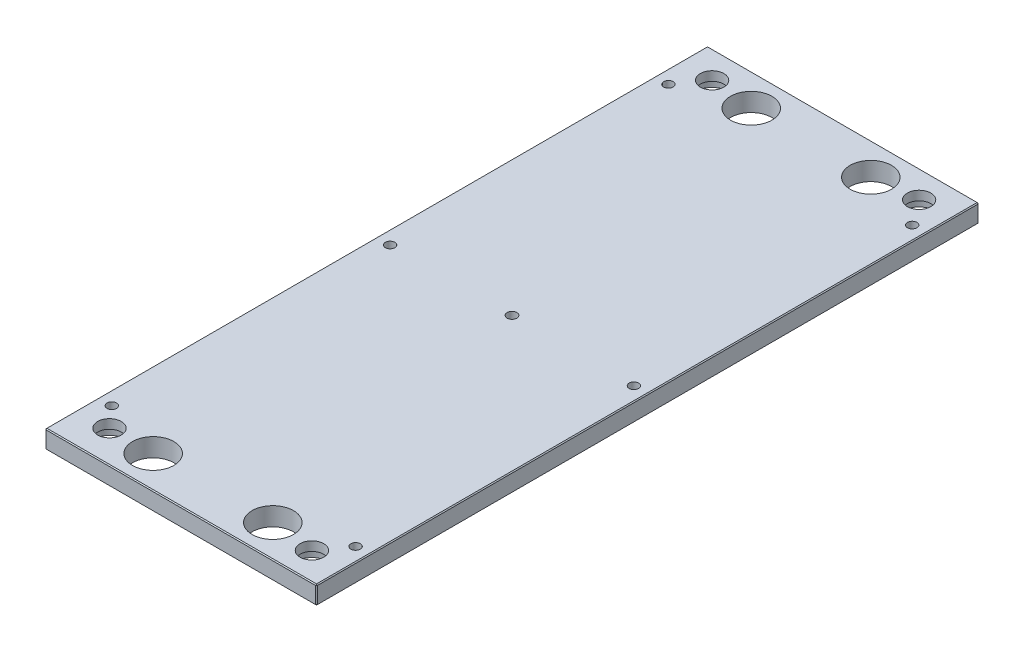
SolidWorks part; units mm, degrees
ref_plane "Plane1" through (0, 0, 0) normal (0, 0, 1) x (1, 0, 0)
ref_plane "Plane2" through (0, 0, 0) normal (0, 1, 0) x (1, 0, 0)
ref_plane "Plane3" through (0, 0, 0) normal (1, 0, 0) x (0, 0, -1)
sketch "Sketch1" plane through (0, 0, 0) normal (0, 0, 1) x (1, 0, 0)
  line L0 (-93.6625, -12.7) -> (93.6625, -12.7)
  line L1 (-93.6625, -12.7) -> (-93.6625, -25.4)
  line L2 (93.6625, -25.4) -> (-93.6625, -25.4)
  line L3 (93.6625, -25.4) -> (93.6625, -12.7)
  dimension "HT" = 12.7
  dimension "W" = 187.325
  dimension "halfW" = 93.6625
extrude "Base-Extrude" add sketch "Sketch1" along normal mid plane 457.2
hole_wizard "RP1" positions "RP1ctrl" profile "RP1rev" legacy
sketch "RP1ctrl" plane through (0, -25.4, 0) normal (0, -1, 0) x (1, 0, 0)
  point P0 (71.4375, -209.55)
sketch "RP1rev" plane through (71.4375, -25.4, -209.55) normal (1, 0, 0) x (0, 0, -1)
  line L0 (0, 0) -> (0, 12.7)
  line L1 (0, 12.7) -> (8.1359, 12.7)
  line L2 (8.1359, 12.7) -> (8.1359, 6.35)
  line L3 (8.1359, 6.35) -> (11.9062, 6.35)
  line L4 (11.9062, 6.35) -> (11.9062, 0)
  line L5 (11.9062, 0) -> (0, 0)
  line L6 (0, 110) -> (0, -10) construction
  dimension "Depth" = 12.7
hole_wizard "RP2" positions "RP2ctrl" profile "RP2rev" legacy
sketch "RP2ctrl" plane through (0, -25.4, 0) normal (0, -1, 0) x (1, 0, 0)
  point P0 (71.4375, 209.55)
sketch "RP2rev" plane through (71.4375, -25.4, 209.55) normal (1, 0, 0) x (0, 0, -1)
  line L0 (0, 0) -> (0, 12.7)
  line L1 (0, 12.7) -> (8.1359, 12.7)
  line L2 (8.1359, 12.7) -> (8.1359, 6.35)
  line L3 (8.1359, 6.35) -> (11.9062, 6.35)
  line L4 (11.9062, 6.35) -> (11.9062, 0)
  line L5 (11.9062, 0) -> (0, 0)
  line L6 (0, 110) -> (0, -10) construction
  dimension "Depth" = 12.7
hole_wizard "RP3" positions "RP3ctrl" profile "RP3rev" legacy
sketch "RP3ctrl" plane through (0, -25.4, 0) normal (0, -1, 0) x (1, 0, 0)
  point P0 (-71.4375, 206.375)
sketch "RP3rev" plane through (-71.4375, -25.4, 206.375) normal (1, 0, 0) x (0, 0, -1)
  line L0 (0, 0) -> (0, 12.7)
  line L1 (0, 12.7) -> (8.1359, 12.7)
  line L2 (8.1359, 12.7) -> (8.1359, 6.35)
  line L3 (8.1359, 6.35) -> (11.9062, 6.35)
  line L4 (11.9062, 6.35) -> (11.9062, 0)
  line L5 (11.9062, 0) -> (0, 0)
  line L6 (0, 110) -> (0, -10) construction
  dimension "Depth" = 12.7
hole_wizard "RP4" positions "RP4ctrl" profile "RP4rev" legacy
sketch "RP4ctrl" plane through (0, -25.4, 0) normal (0, -1, 0) x (1, 0, 0)
  point P0 (-71.4375, -209.55)
sketch "RP4rev" plane through (-71.4375, -25.4, -209.55) normal (1, 0, 0) x (0, 0, -1)
  line L0 (0, 0) -> (0, 12.7)
  line L1 (0, 12.7) -> (8.1359, 12.7)
  line L2 (8.1359, 12.7) -> (8.1359, 6.35)
  line L3 (8.1359, 6.35) -> (11.9062, 6.35)
  line L4 (11.9062, 6.35) -> (11.9062, 0)
  line L5 (11.9062, 0) -> (0, 0)
  line L6 (0, 110) -> (0, -10) construction
  dimension "Depth" = 12.7
hole_wizard "SP" positions "SPctrl" profile "SPrev" legacy
sketch "SPctrl" plane through (0, -25.4, 0) normal (0, -1, 0) x (1, 0, 0)
  point P0 (0, 0)
sketch "SPrev" plane through (0, -25.4, 0) normal (1, 0, 0) x (0, 0, -1)
  line L0 (0, 0) -> (0, 12.7)
  line L1 (0, 12.7) -> (3.3734, 12.7)
  line L2 (3.3734, 12.7) -> (3.3734, 6.35)
  line L3 (3.3734, 6.35) -> (6.35, 6.35)
  line L4 (6.35, 6.35) -> (6.35, 0)
  line L5 (6.35, 0) -> (0, 0)
  line L6 (0, 110) -> (0, -10) construction
  dimension "Diameter" = 6.7469
  dimension "Depth" = 12.7
  dimension "C-Bore Diameter" = 12.7
  dimension "C-Bore Depth" = 6.35
other "Tap1"
sketch "Tap1ctrl" plane through (0, -12.7, 0) normal (0, 1, 0) x (-1, 0, 0)
  circle A0 centre (-84.1375, -192.0875) radius 3.2639
sketch "Tap2ctrl" plane through (-4.6859, -12.7, 559.3634) normal (0, 1, 0) x (-1, 0, 0)
  circle A0 centre (-88.8234, -367.2759) radius 3.2639
other "Tap2"
sketch "Tap3ctrl" plane through (-246.9305, -12.7, 555.6004) normal (0, 1, 0) x (-1, 0, 0)
  circle A0 centre (-162.793, -363.5129) radius 3.2639
other "Tap3"
sketch "Tap4ctrl" plane through (-242.1128, -12.7, 3.0677) normal (0, 1, 0) x (-1, 0, 0)
  circle A0 centre (-157.9753, -195.1552) radius 3.2639
other "Tap4"
chamfer "EdgeBreak" distance 0.635 angle 45 12 edges at (93.6625, -19.05, 228.6) (0, -12.7, 228.6) (-93.6625, -19.05, 228.6) (0, -12.7, -228.6) (93.6625, -19.05, -228.6) (0, -25.4, -228.6) (-93.6625, -19.05, -228.6) (0, -25.4, 228.6) (-93.6625, -12.7, 0) (93.6625, -12.7, 0) (93.6625, -25.4, 0) (-93.6625, -25.4, 0)
other "Guide1"
sketch "Eject1" plane through (0, -12.7, 0) normal (0, 1, 0) x (-1, 0, 0)
  circle A0 centre (-41.275, -206.375) radius 14.2875
sketch "Eject2" plane through (-6.583, -12.7, 141.4013) normal (0, 1, 0) x (-1, 0, 0)
  circle A0 centre (-47.858, 64.9737) radius 14.2875
other "Guide2"
sketch "Eject3" plane through (-89.1847, -12.7, 141.2568) normal (0, 1, 0) x (-1, 0, 0)
  circle A0 centre (-47.9097, 65.1182) radius 14.2875
other "Guide3"
sketch "Eject4" plane through (-87.4522, -12.7, -4.2965) normal (0, 1, 0) x (-1, 0, 0)
  circle A0 centre (-46.1772, -202.0785) radius 14.2875
other "Guide4"
sketch "Eject5" plane through (-44.7398, -12.7, -3.6657) normal (0, 1, 0) x (-1, 0, 0)
  line L0 (-44.7398, 53.6657) -> (-44.7398, -46.3343) construction
  circle A0 centre (-44.7398, -202.7093) radius 14.2875
other "Guide5" [suppressed]
sketch "Eject6" plane through (-49.7118, -12.7, 139.2167) normal (0, 1, 0) x (-1, 0, 0)
  line L0 (-49.7118, -89.2167) -> (-49.7118, -189.2167) construction
  circle A0 centre (-49.7118, 67.1583) radius 14.2875
other "Guide6" [suppressed]
sketch "Sketch2" plane through (-12.7244, -12.7, 75.2256) normal (0, 1, 0) x (-1, 0, 0)
  line L0 (37.2756, -75.2256) -> (-62.7244, -75.2256) construction
  circle A0 centre (-96.8619, -75.2256) radius 3.2639
  dimension "MinDia" = 6.5278
other "Tap5"
sketch "Sketch3" plane through (-178.3085, -12.7, 80.2428) normal (0, 1, 0) x (-1, 0, 0)
  line L0 (-128.3085, -80.2428) -> (-228.3085, -80.2428) construction
  circle A0 centre (-94.171, -80.2428) radius 3.2639
  dimension "MinDia" = 6.5278
other "Tap6"
